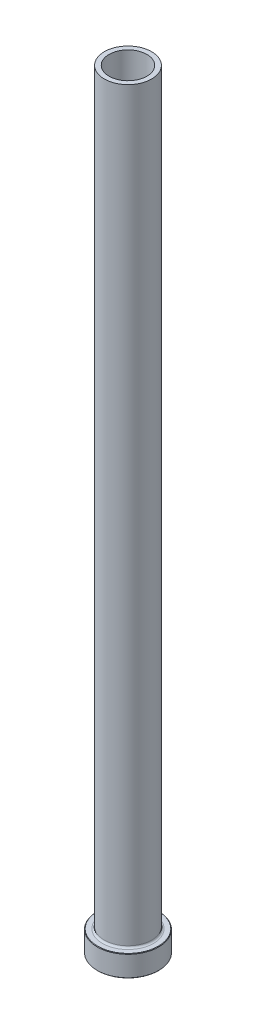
SolidWorks part; units mm, degrees
ref_plane "Front Plane" through (0, 0, 0) normal (0, 0, 1) x (1, 0, 0)
ref_plane "Top Plane" through (0, 0, 0) normal (0, 1, 0) x (1, 0, 0)
ref_plane "Right Plane" through (0, 0, 0) normal (1, 0, 0) x (0, 0, -1)
sketch "Sketch1" plane through (0, 0, 0) normal (0, 0, 1) x (1, 0, 0)
  line L0 (-8, 325) -> (-10, 325)
  line L1 (-10, 325) -> (-10, 9)
  line L2 (-10, 9) -> (-13, 9)
  line L3 (-13, 9) -> (-13, 0)
  line L4 (14.3, 0) -> (-14.3, 0) construction
  line L5 (-13, 0) -> (-8.25, 0)
  line L6 (-8, 270) -> (-8, 325)
  line L7 (0, 92.1877) -> (0, -15.5353) construction
  line L8 (0, -14.3) -> (0, 14.3) construction
  line L9 (-8, 270) -> (-8.25, 258)
  line L10 (-8.25, 258) -> (-8.25, 0)
  dimension "D1" = 0.25
  dimension "ID" = 16
  dimension "OD" = 20
  dimension "L" = 325
  dimension "H" = 26
  dimension "T" = 9
  dimension "N" = 55
  dimension "D2" = 12
revolve "Revolve1" add sketch "Sketch1" angle 360 about L7
fillet "Fillet1" radius 0.8 1 edges at (0, 9, 10)
chamfer "Chamfer1" distance 0.2 angle 45 2 edges at (0, 9, 13) (0, 0, 13)
chamfer "Chamfer3" distance 0.5 angle 45 1 edges at (0, 0, 8.25)
